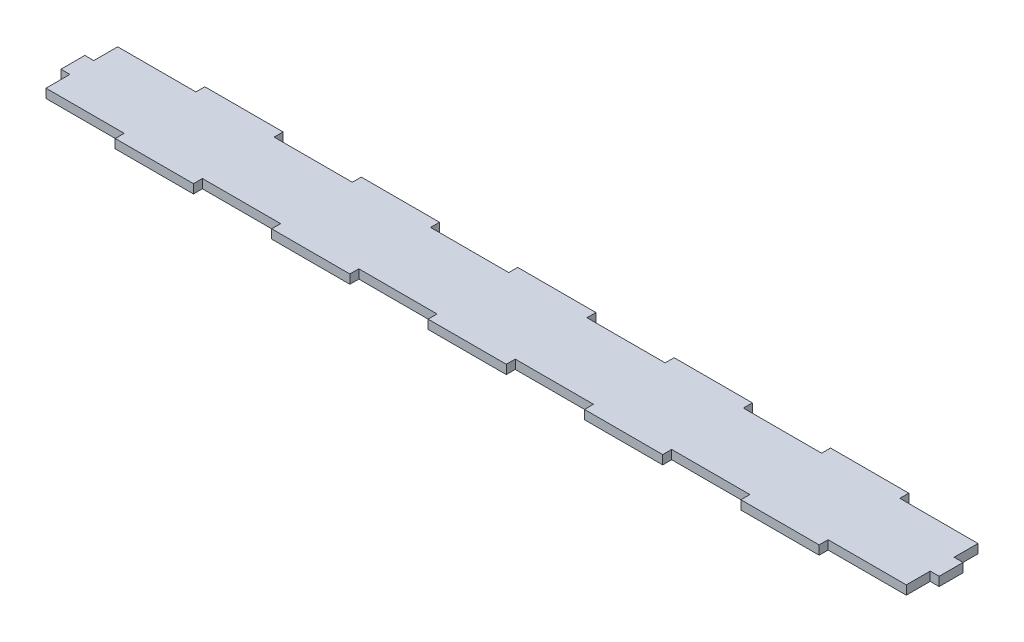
SolidWorks part; units mm, degrees
ref_plane "Front Plane" through (0, 0, 0) normal (0, 0, 1) x (1, 0, 0)
ref_plane "Top Plane" through (0, 0, 0) normal (0, 1, 0) x (1, 0, 0)
ref_plane "Right Plane" through (0, 0, 0) normal (1, 0, 0) x (0, 0, -1)
sketch "Sketch2" plane through (0, 0, 0) normal (0, 1, 0) x (1, 0, 0)
  line L0 (-180.1091, 25.4) -> (-152.4, 25.4)
  line L1 (-152.4, 25.4) -> (-152.4, 28.575)
  line L2 (-152.4, 28.575) -> (-124.6909, 28.575)
  line L3 (-124.6909, 28.575) -> (-124.6909, 25.4)
  line L4 (-124.6909, 25.4) -> (-96.9818, 25.4)
  line L5 (-96.9818, 25.4) -> (-96.9818, 28.575)
  line L6 (-96.9818, 28.575) -> (-69.2727, 28.575)
  line L7 (-69.2727, 28.575) -> (-69.2727, 25.4)
  line L8 (-69.2727, 25.4) -> (-41.5636, 25.4)
  line L9 (-41.5636, 25.4) -> (-41.5636, 28.575)
  line L10 (-41.5636, 28.575) -> (-13.8545, 28.575)
  line L11 (-13.8545, 28.575) -> (-13.8545, 25.4)
  line L12 (-13.8545, 25.4) -> (13.8545, 25.4)
  line L13 (13.8545, 25.4) -> (13.8545, 28.575)
  line L14 (13.8545, 28.575) -> (41.5636, 28.575)
  line L15 (41.5636, 28.575) -> (41.5636, 25.4)
  line L16 (41.5636, 25.4) -> (69.2727, 25.4)
  line L17 (69.2727, 25.4) -> (69.2727, 28.575)
  line L18 (69.2727, 28.575) -> (96.9818, 28.575)
  line L19 (96.9818, 28.575) -> (96.9818, 25.4)
  line L20 (96.9818, 25.4) -> (124.6909, 25.4)
  line L21 (124.6909, 25.4) -> (124.6909, 16.9333)
  line L22 (124.6909, 16.9333) -> (127.8659, 16.9333)
  line L23 (127.8659, 16.9333) -> (127.8659, 8.4667)
  line L24 (127.8659, 8.4667) -> (124.6909, 8.4667)
  line L25 (124.6909, 8.4667) -> (124.6909, 0)
  line L26 (124.6909, 0) -> (96.9818, 0)
  line L27 (96.9818, 0) -> (96.9818, -3.175)
  line L28 (96.9818, -3.175) -> (69.2727, -3.175)
  line L29 (69.2727, -3.175) -> (69.2727, 0)
  line L30 (69.2727, 0) -> (41.5636, 0)
  line L31 (41.5636, 0) -> (41.5636, -3.175)
  line L32 (41.5636, -3.175) -> (13.8545, -3.175)
  line L33 (13.8545, -3.175) -> (13.8545, 0)
  line L34 (13.8545, 0) -> (-13.8545, 0)
  line L35 (-13.8545, 0) -> (-13.8545, -3.175)
  line L36 (-13.8545, -3.175) -> (-41.5636, -3.175)
  line L37 (-41.5636, -3.175) -> (-41.5636, 0)
  line L38 (-41.5636, 0) -> (-69.2727, 0)
  line L39 (-69.2727, 0) -> (-69.2727, -3.175)
  line L40 (-69.2727, -3.175) -> (-96.9818, -3.175)
  line L41 (-96.9818, -3.175) -> (-96.9818, 0)
  line L42 (-96.9818, 0) -> (-124.6909, 0)
  line L43 (-124.6909, 0) -> (-124.6909, -3.175)
  line L44 (-124.6909, -3.175) -> (-152.4, -3.175)
  line L45 (-152.4, -3.175) -> (-152.4, 0)
  line L46 (-152.4, 0) -> (-180.1091, 0)
  line L47 (-180.1091, 0) -> (-180.1091, 8.4667)
  line L48 (-180.1091, 8.4667) -> (-183.2841, 8.4667)
  line L49 (-183.2841, 8.4667) -> (-183.2841, 16.9333)
  line L50 (-183.2841, 16.9333) -> (-180.1091, 16.9333)
  line L51 (-180.1091, 16.9333) -> (-180.1091, 25.4)
extrude "Boss-Extrude1" add sketch "Sketch2" along normal blind 3.175
equation "\"innerWidth\"= 12in"
equation "\"innerDepth\" = 1in"
equation "\"innerHeight\"= 1.5in"
equation "\"matThickness\"= .125in"
equation "\"latchWidth\"=20mm"
equation "\"D1@Sketch2\"=\"matThickness\""
equation "\"D2@Sketch2\"=\"innerWidth\""
equation "\"D3@Sketch2\"=\"innerDepth\""
equation "\"D1@Boss-Extrude1\"=\"matThickness\""
